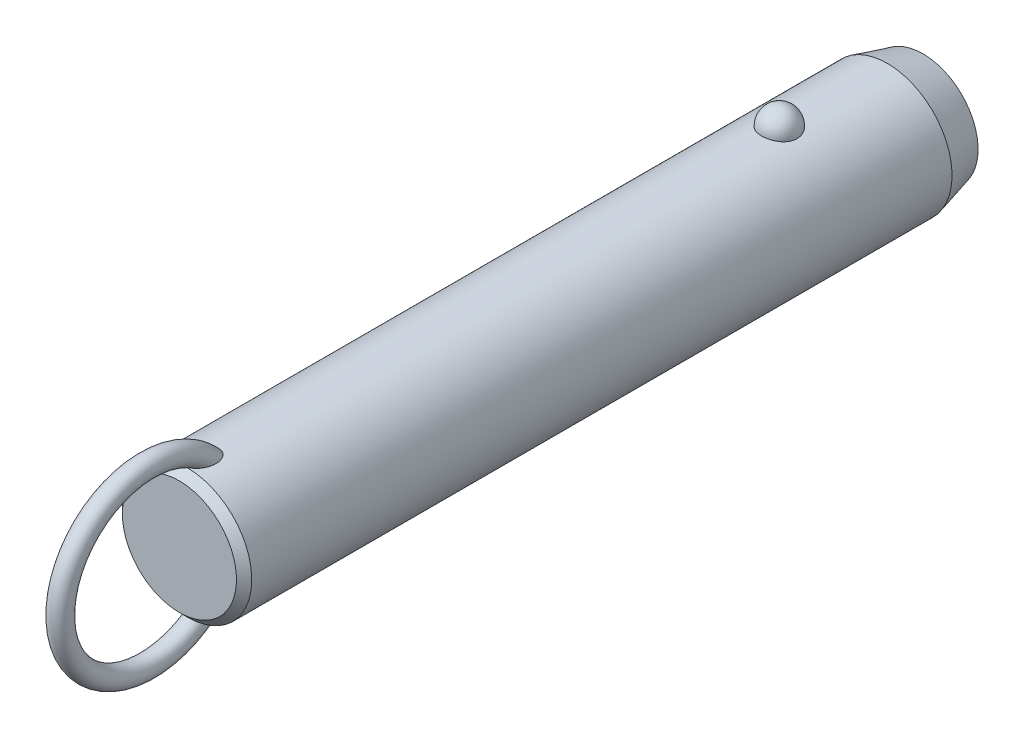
SolidWorks part; units mm, degrees
ref_plane "Front Plane" through (0, 0, 0) normal (0, 0, 1) x (1, 0, 0)
ref_plane "Top Plane" through (0, 0, 0) normal (0, 1, 0) x (1, 0, 0)
ref_plane "Right Plane" through (0, 0, 0) normal (1, 0, 0) x (0, 0, -1)
sketch "Sketch2" plane through (0, 0, 0) normal (0, 0, 1) x (1, 0, 0)
  circle A0 centre (0, 0) radius 12.7
  point P3 (0, 12.7)
  dimension "D1" = 25.4
extrude "Boss-Extrude1" add sketch "Sketch2" along normal blind 101.6
sketch "Sketch3" plane through (0, 0, 0) normal (0, 0, -1) x (-1, 0, 0)
  circle A0 centre (0, 0) radius 12.7
  dimension "D1" = 25.4
extrude "Boss-Extrude2" add sketch "Sketch3" along normal blind 31.7
chamfer "Chamfer1" distance 7 angle 15 1 edges at (-12.7, 0, -31.7)
sketch "Sketch12" plane through (0, 0, 0) normal (1, 0, 0) x (0, 0, -1)
  line L0 (-101.6, 12.7) -> (-101.6, -12.7) construction
  point P0 (-101.6, 0)
sketch "Sketch13" plane through (0, 0, 0) normal (1, 0, 0) x (0, 0, -1)
  circle A0 centre (-120.65, 0) radius 19.05
  point P2 (-101.6, 0)
  dimension "D1" = 38.1
sketch "Sketch14" plane through (0, 0, 0) normal (0, 1, 0) x (1, 0, 0)
  circle A0 centre (0, -103.6) radius 2
  point P2 (0, -101.6)
  dimension "D1" = 4
sweep "Sweep1" add profiles "Sketch14" path "Sketch13"
sketch "Sketch15" plane through (0, 0, 101.6) normal (0, 0, 1) x (1, 0, 0)
  circle A0 centre (0, 0) radius 12.7
  dimension "D1" = 25.4
extrude "Boss-Extrude3" add sketch "Sketch15" along normal blind 12.7
chamfer "Chamfer2" distance 1.5 angle 45 1 edges at (12.7, 0, 114.3)
sketch "Sketch18" plane through (0, 0, 0) normal (1, 0, 0) x (0, 0, -1)
  line L0 (24.7, 12.7) -> (-106.451, 12.7) construction
  line L1 (3.5, 16.2) -> (3.5, 9.2)
  line L2 (-106.451, -12.7) -> (24.7, -12.7) construction
  arc A0 (3.5, 16.2) -> (3.5, 9.2) centre (3.5, 12.7) ccw
  point P4 (0, 12.7)
  dimension "D1" = 28.9
revolve "Revolve1" add sketch "Sketch18" angle 360 about L1
